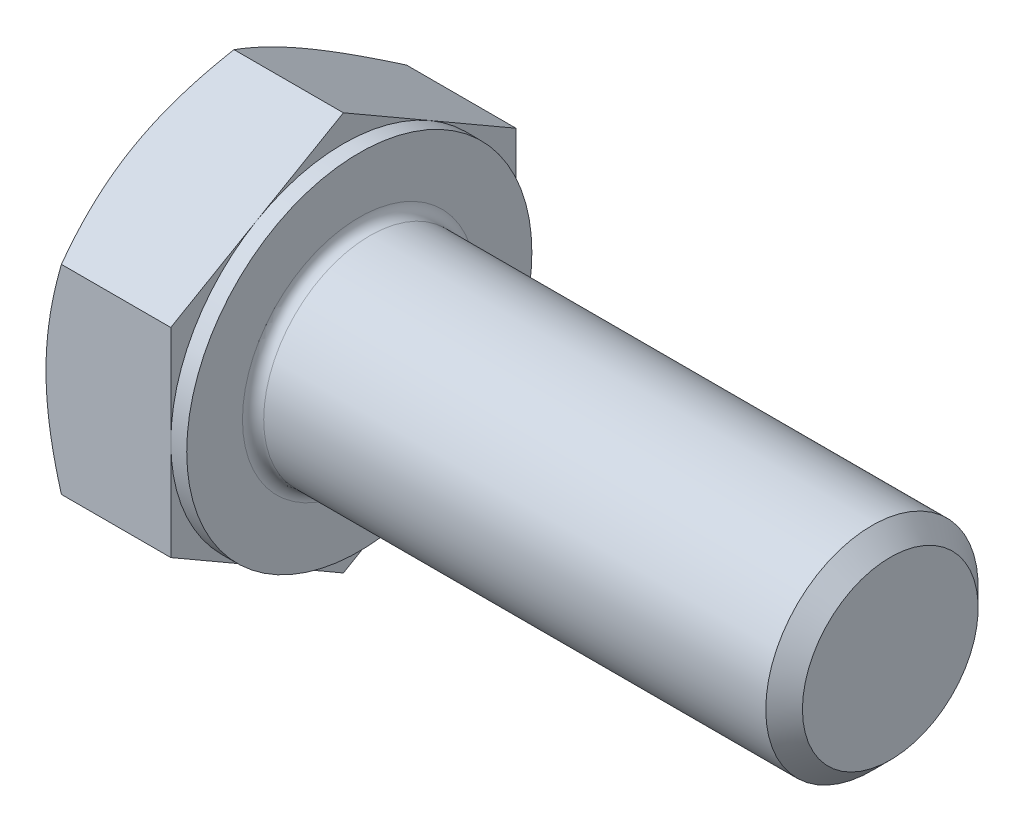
SolidWorks part; units mm, degrees
ref_plane "Plane1" through (0, 0, 0) normal (0, 0, 1) x (1, 0, 0)
ref_plane "Plane2" through (0, 0, 0) normal (0, 1, 0) x (1, 0, 0)
ref_plane "Plane3" through (0, 0, 0) normal (1, 0, 0) x (0, 0, -1)
sketch "Sketch1" plane through (0, 0, 0) normal (1, 0, 0) x (0, 0, -1)
  line L0 (6.5, 3.7528) -> (6.5, -3.7528)
  line L1 (-6.5, 3.7528) -> (-6.5, -3.7528)
  line L2 (6.5, -3.7528) -> (0, -7.5056)
  line L3 (0, -7.5056) -> (-6.5, -3.7528)
  line L4 (6.5, 3.7528) -> (0, 7.5056)
  line L5 (0, 7.5056) -> (-6.5, 3.7528)
  dimension "Width_flats" = 13
  dimension "D2" = 120
  dimension "D3" = 6.5
  dimension "D4" = 6.5
  dimension "D5" = 6.5
extrude "BaseHead" add sketch "Sketch1" along normal blind 5.3
sketch "BodySke" plane through (0, 0, 0) normal (0, 0, 1) x (1, 0, 0)
  line L0 (0, 3.7528) -> (0, -3.7528) construction
  line L1 (0, 0) -> (25.3, 0)
  line L2 (0, 0) -> (0, 4)
  line L3 (0, 4) -> (24.6095, 4)
  line L4 (25.3, 0) -> (25.3, 3.3095)
  line L5 (5.3, 7.5056) -> (5.3, 3.7528) construction
  line L6 (25.3, 3.3095) -> (24.6095, 4)
  line L7 (0, 0) -> (96.52, 0) construction
  line L8 (25.3, -3.3095) -> (24.6095, -4) construction
  line L9 (0, -4) -> (24.6095, -4) construction
  line L10 (6.55, 15.24) -> (6.55, -1.27) construction
  line L12 (5.3, 3.7528) -> (5.3, -3.7528) construction
  dimension "Length" = 20
  dimension "Body_ch_ang" = 45
  dimension "Diameter" = 8
  dimension "Minor_dia" = 6.619
  dimension "Advance" = 1.25
revolve "BaseBody" add sketch "BodySke"
fillet "HeadFillet" radius 0.4 1 edges at (5.3, 0, -4)
sketch "Sketch3" plane through (0, 0, 0) normal (0, 0, 1) x (1, 0, 0)
  line L0 (0, 6.5) -> (3.4673, 12.5056)
  line L1 (0, 7.5056) -> (0, 3.7528) construction
  line L2 (3.4673, 12.5056) -> (3.4673, 17.5056)
  line L3 (3.4673, 17.5056) -> (-10, 17.5056)
  line L4 (-10, 17.5056) -> (-10, 6.5)
  line L5 (-10, 6.5) -> (0, 6.5)
  line L6 (0, 0) -> (99.06, 0) construction
  line L7 (5.3, 7.5056) -> (0, 7.5056) construction
  dimension "D1" = 6.5
  dimension "D2" = 5
  dimension "D3" = 10
  dimension "D4" = 5
  dimension "Head_ch_ang" = 30
revolve "HeadChamfer" cut sketch "Sketch3" angle 360 about L6
sketch "Sketch4" plane through (0, 0, 0) normal (0, 0, 1) x (1, 0, 0)
  line L1 (5.3, 7.5056) -> (5.3, 3.7528) construction
  line L2 (5.3, 6.5) -> (4.7, 6.5)
  line L3 (5.3, 6.5) -> (5.3, 17.5056)
  line L4 (5.3, 17.5056) -> (4.7, 17.5056)
  line L5 (0, 0) -> (95.25, 0) construction
  line L6 (0, 0) -> (96.52, 0) construction
  line L7 (4.7, 6.5) -> (4.7, 17.5056)
  line L8 (5.3, 7.5056) -> (0.5806, 7.5056) construction
  dimension "D1" = 13
  dimension "D2" = 10
  dimension "Bearing_ht" = 0.6
revolve "BearingFace" cut sketch "Sketch4" angle 360 about L5
sketch "ThdSchSke" plane through (0, 0, 0) normal (0, 0, 1) x (1, 0, 0)
  line L0 (6.55, -3.3095) -> (6.0665, -4)
  line L1 (6.55, -3.3095) -> (7.0335, -4)
  line L2 (7.0335, -4) -> (7.0335, -5)
  line L3 (-3.175, 0) -> (5.1513, 0) construction
  line L5 (7.0335, -5) -> (6.0665, -5)
  line L6 (6.0665, -5) -> (6.0665, -4)
  dimension "Thread_minor" = 6.619
  dimension "Diameter" = 8
  dimension "Start" = 6.55
  dimension "SideAngle" = 55
  dimension "VeeAngle" = 70
  dimension "Overcut" = 10
revolve "ThreadSchematic" [suppressed] cut sketch "ThdSchSke" angle 360 about L3
pattern_linear "ThdSchPat" [suppressed]
equation "\"D3@Sketch1\" = \"Width_flats@Sketch1\" / 2"
equation "\"D4@Sketch1\" = \"D3@Sketch1\""
equation "\"D5@Sketch1\" = \"D4@Sketch1\""
equation "\"Thread_minor@ThreadCosmetic\" = \"Minor_dia@BodySke\""
equation "\"D1@Sketch3\" = \"Width_flats@Sketch1\" / 2"
equation "\"D1@Sketch4\" = \"Width_flats@Sketch1\""
equation "\"Thread_length@ThreadCosmetic\" = \"Length@BodySke\" - \"Advance@BodySke\""
equation "\"Thread_minor@ThdSchSke\" = \"Minor_dia@BodySke\""
equation "\"Diameter@ThdSchSke\" = \"Diameter@BodySke\""
equation "\"Overcut@ThdSchSke\" = \"Diameter@BodySke\" * 1.25"
equation "\"Start@ThdSchSke\" = \"Head_ht@BaseHead\" + \"Length@BodySke\" - \"Thread_length@ThreadCosmetic\"  '---Non-countersunk---"
equation "\"Num_threads@ThdSchPat\" = int( \"Thread_length@ThreadCosmetic\" / \"Advance@BodySke\" + 0.999 )  + 1"
equation "\"Advance@ThdSchPat\" = \"Thread_length@ThreadCosmetic\" /  (\"Num_threads@ThdSchPat\" - 1) 'relax it"
equation "\"Num_threads@ThdSchPat\" = \"Num_threads@ThdSchPat\" - sgn( \"Num_threads@ThdSchPat\" - 1) '---chamfered tips only---"
